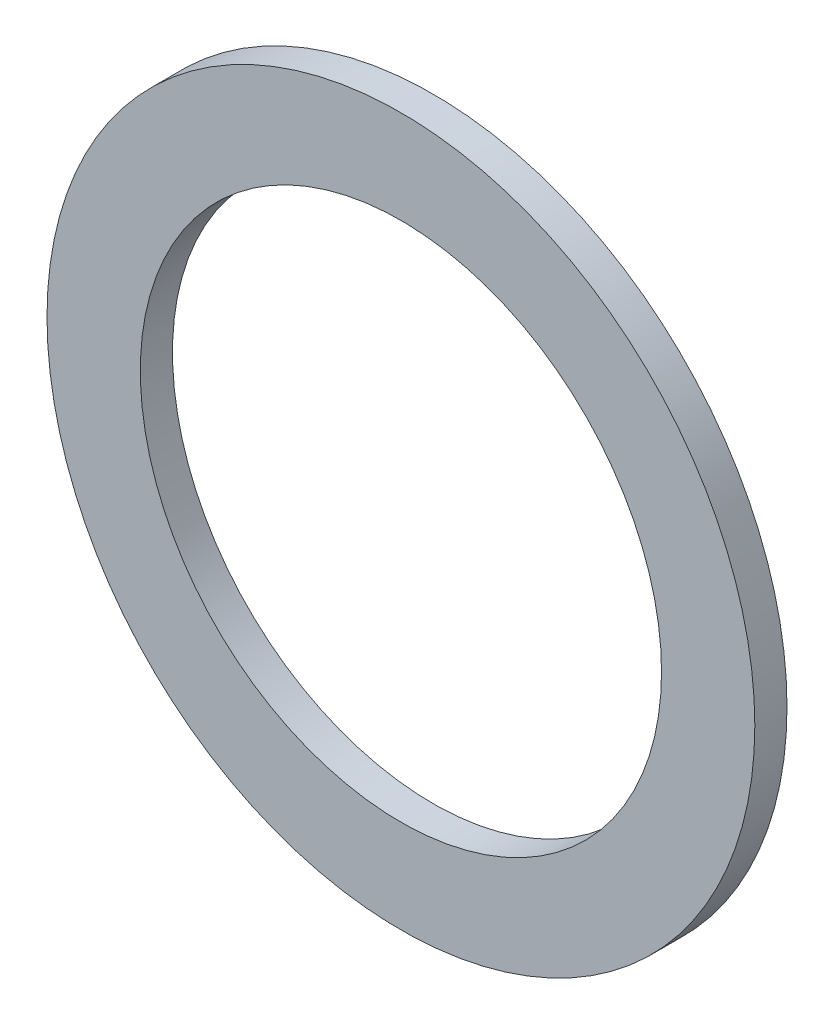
SolidWorks part; units mm, degrees
ref_plane "Face" through (0, 0, 0) normal (0, 0, 1) x (1, 0, 0)
ref_plane "Dessus" through (0, 0, 0) normal (0, 1, 0) x (1, 0, 0)
ref_plane "Droite" through (0, 0, 0) normal (1, 0, 0) x (0, 0, -1)
sketch "Esquisse1" plane through (0, 0, 0) normal (0, 0, 1) x (1, 0, 0)
  circle A0 centre (0, 0) radius 55
  circle A1 centre (0, 0) radius 40.5
  dimension "D1" = 110
  dimension "D2" = 81
extrude "Extrusion1" add sketch "Esquisse1" along normal blind 5
